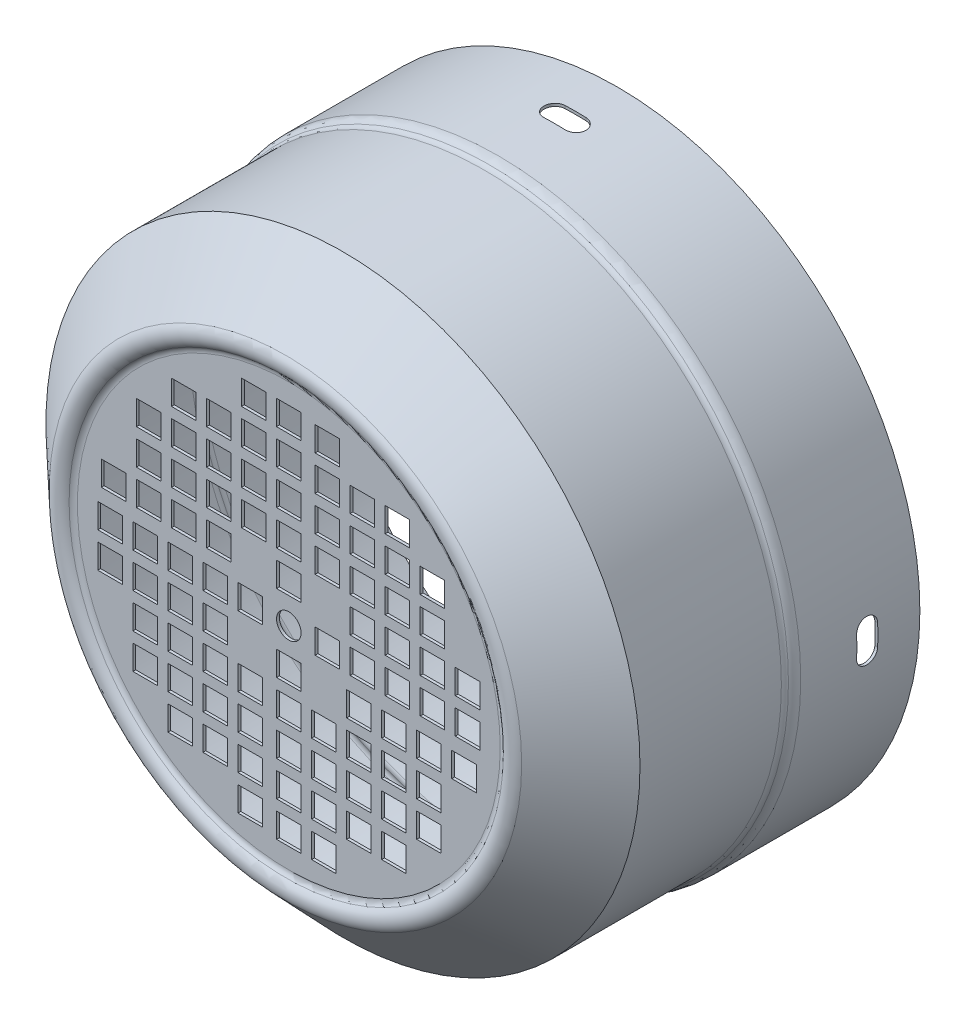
SolidWorks part; units mm, degrees
ref_plane "前视基准面" through (0, 0, 0) normal (0, 0, 1) x (1, 0, 0)
ref_plane "上视基准面" through (0, 0, 0) normal (0, 1, 0) x (1, 0, 0)
ref_plane "右视基准面" through (0, 0, 0) normal (1, 0, 0) x (0, 0, -1)
sketch "草图1" plane through (0, 0, 0) normal (0, 1, 0) x (1, 0, 0)
  line L0 (0, 0) -> (0, 95.7915) construction
  line L1 (83.9685, 57) -> (83.9685, 56.8734)
  line L2 (85.4963, 95) -> (85.4963, 61)
  line L4 (83.9685, 56.8734) -> (83.9685, 17)
  line L5 (0, 2) -> (60.3336, 2)
  line L6 (83.9685, 17) -> (66.8675, 0.8208)
  arc A0 (85.4963, 61) -> (84.7324, 59) centre (82.4963, 61) cw
  arc A1 (83.9685, 57) -> (84.7324, 59) centre (86.9685, 57) cw
  arc A2 (66.8675, 0.8208) -> (62.5697, 1) centre (64.8057, 3) cw
  arc A3 (62.5697, 1) -> (60.3336, 2) centre (60.3336, -1) ccw
  point P15 (66, 0)
  dimension "D2" = 3
  dimension "D3" = 3
  dimension "D9" = 3
  dimension "D11" = 3
  dimension "D1" = 85.5
  dimension "D4" = 36
  dimension "D5" = 2
  dimension "D6" = 78
  dimension "D7" = 95
  dimension "D8" = 66
revolve "旋转-薄壁2" add sketch "草图1" angle 360 about L0
sketch "草图2" plane through (0, 0, -1.2) normal (0, 0, 1) x (1, 0, 0)
  line L0 (7.5, 3.5) -> (7.5, -3.5)
  line L2 (7.5, 3.5) -> (14.5, 3.5)
  line L3 (14.5, 3.5) -> (14.5, -3.5)
  line L4 (14.5, -3.5) -> (7.5, -3.5)
  line L18 (17.5, 3.5) -> (17.5, -3.5)
  line L19 (24.5, -3.5) -> (17.5, -3.5)
  line L20 (24.5, 3.5) -> (24.5, -3.5)
  line L21 (17.5, 3.5) -> (24.5, 3.5)
  line L22 (27.5, 3.5) -> (27.5, -3.5)
  line L23 (34.5, -3.5) -> (27.5, -3.5)
  line L24 (34.5, 3.5) -> (34.5, -3.5)
  line L25 (27.5, 3.5) -> (34.5, 3.5)
  line L26 (37.5, 3.5) -> (37.5, -3.5)
  line L27 (44.5, -3.5) -> (37.5, -3.5)
  line L28 (44.5, 3.5) -> (44.5, -3.5)
  line L29 (37.5, 3.5) -> (44.5, 3.5)
  line L30 (47.5, 3.5) -> (47.5, -3.5)
  line L31 (54.5, -3.5) -> (47.5, -3.5)
  line L32 (54.5, 3.5) -> (54.5, -3.5)
  line L33 (47.5, 3.5) -> (54.5, 3.5)
  line L38 (7.5, 23.5) -> (7.5, 16.5)
  line L39 (14.5, 16.5) -> (7.5, 16.5)
  line L40 (14.5, 23.5) -> (14.5, 16.5)
  line L41 (7.5, 23.5) -> (14.5, 23.5)
  line L42 (7.5, 33.5) -> (7.5, 26.5)
  line L43 (14.5, 26.5) -> (7.5, 26.5)
  line L44 (14.5, 33.5) -> (14.5, 26.5)
  line L45 (7.5, 33.5) -> (14.5, 33.5)
  line L46 (7.5, 43.5) -> (7.5, 36.5)
  line L47 (14.5, 36.5) -> (7.5, 36.5)
  line L48 (14.5, 43.5) -> (14.5, 36.5)
  line L49 (7.5, 43.5) -> (14.5, 43.5)
  line L50 (7.5, 53.5) -> (7.5, 46.5)
  line L51 (14.5, 46.5) -> (7.5, 46.5)
  line L52 (14.5, 53.5) -> (14.5, 46.5)
  line L53 (7.5, 53.5) -> (14.5, 53.5)
  line L54 (17.5, 13.5) -> (17.5, 6.5)
  line L55 (24.5, 6.5) -> (17.5, 6.5)
  line L56 (24.5, 13.5) -> (24.5, 6.5)
  line L57 (17.5, 13.5) -> (24.5, 13.5)
  line L58 (27.5, 13.5) -> (27.5, 6.5)
  line L59 (34.5, 6.5) -> (27.5, 6.5)
  line L60 (34.5, 13.5) -> (34.5, 6.5)
  line L61 (27.5, 13.5) -> (34.5, 13.5)
  line L62 (37.5, 13.5) -> (37.5, 6.5)
  line L63 (44.5, 6.5) -> (37.5, 6.5)
  line L64 (44.5, 13.5) -> (44.5, 6.5)
  line L65 (37.5, 13.5) -> (44.5, 13.5)
  line L66 (47.5, 13.5) -> (47.5, 6.5)
  line L67 (54.5, 6.5) -> (47.5, 6.5)
  line L68 (54.5, 13.5) -> (54.5, 6.5)
  line L69 (47.5, 13.5) -> (54.5, 13.5)
  line L70 (17.5, 23.5) -> (17.5, 16.5)
  line L71 (24.5, 16.5) -> (17.5, 16.5)
  line L72 (24.5, 23.5) -> (24.5, 16.5)
  line L73 (17.5, 23.5) -> (24.5, 23.5)
  line L74 (27.5, 23.5) -> (27.5, 16.5)
  line L75 (34.5, 16.5) -> (27.5, 16.5)
  line L76 (34.5, 23.5) -> (34.5, 16.5)
  line L77 (27.5, 23.5) -> (34.5, 23.5)
  line L78 (37.5, 23.5) -> (37.5, 16.5)
  line L79 (44.5, 16.5) -> (37.5, 16.5)
  line L80 (44.5, 23.5) -> (44.5, 16.5)
  line L81 (37.5, 23.5) -> (44.5, 23.5)
  line L82 (17.5, 33.5) -> (17.5, 26.5)
  line L83 (24.5, 26.5) -> (17.5, 26.5)
  line L84 (24.5, 33.5) -> (24.5, 26.5)
  line L85 (17.5, 33.5) -> (24.5, 33.5)
  line L86 (27.5, 33.5) -> (27.5, 26.5)
  line L87 (34.5, 26.5) -> (27.5, 26.5)
  line L88 (34.5, 33.5) -> (34.5, 26.5)
  line L89 (27.5, 33.5) -> (34.5, 33.5)
  line L90 (37.5, 33.5) -> (37.5, 26.5)
  line L91 (44.5, 26.5) -> (37.5, 26.5)
  line L92 (44.5, 33.5) -> (44.5, 26.5)
  line L93 (37.5, 33.5) -> (44.5, 33.5)
  line L94 (17.5, 43.5) -> (17.5, 36.5)
  line L95 (24.5, 36.5) -> (17.5, 36.5)
  line L96 (24.5, 43.5) -> (24.5, 36.5)
  line L97 (17.5, 43.5) -> (24.5, 43.5)
  line L98 (27.5, 43.5) -> (27.5, 36.5)
  line L99 (34.5, 36.5) -> (27.5, 36.5)
  line L100 (34.5, 43.5) -> (34.5, 36.5)
  line L101 (27.5, 43.5) -> (34.5, 43.5)
  line L102 (3.5, -7.5) -> (-3.5, -7.5)
  line L103 (-3.5, -14.5) -> (-3.5, -7.5)
  line L104 (3.5, -14.5) -> (-3.5, -14.5)
  line L105 (3.5, -7.5) -> (3.5, -14.5)
  line L106 (3.5, -17.5) -> (-3.5, -17.5)
  line L107 (-3.5, -24.5) -> (-3.5, -17.5)
  line L108 (3.5, -24.5) -> (-3.5, -24.5)
  line L109 (3.5, -17.5) -> (3.5, -24.5)
  line L110 (3.5, -27.5) -> (-3.5, -27.5)
  line L111 (-3.5, -34.5) -> (-3.5, -27.5)
  line L112 (3.5, -34.5) -> (-3.5, -34.5)
  line L113 (3.5, -27.5) -> (3.5, -34.5)
  line L114 (3.5, -37.5) -> (-3.5, -37.5)
  line L115 (-3.5, -44.5) -> (-3.5, -37.5)
  line L116 (3.5, -44.5) -> (-3.5, -44.5)
  line L117 (3.5, -37.5) -> (3.5, -44.5)
  line L118 (3.5, -47.5) -> (-3.5, -47.5)
  line L119 (-3.5, -54.5) -> (-3.5, -47.5)
  line L120 (3.5, -54.5) -> (-3.5, -54.5)
  line L121 (3.5, -47.5) -> (3.5, -54.5)
  line L122 (13.5, -47.5) -> (6.5, -47.5)
  line L123 (6.5, -54.5) -> (6.5, -47.5)
  line L124 (13.5, -54.5) -> (6.5, -54.5)
  line L125 (13.5, -47.5) -> (13.5, -54.5)
  line L126 (13.5, -37.5) -> (6.5, -37.5)
  line L127 (6.5, -44.5) -> (6.5, -37.5)
  line L128 (13.5, -44.5) -> (6.5, -44.5)
  line L129 (13.5, -37.5) -> (13.5, -44.5)
  line L130 (13.5, -27.5) -> (6.5, -27.5)
  line L131 (6.5, -34.5) -> (6.5, -27.5)
  line L132 (13.5, -34.5) -> (6.5, -34.5)
  line L133 (13.5, -27.5) -> (13.5, -34.5)
  line L134 (13.5, -17.5) -> (6.5, -17.5)
  line L135 (6.5, -24.5) -> (6.5, -17.5)
  line L136 (13.5, -24.5) -> (6.5, -24.5)
  line L137 (13.5, -17.5) -> (13.5, -24.5)
  line L142 (23.5, -7.5) -> (16.5, -7.5)
  line L143 (16.5, -14.5) -> (16.5, -7.5)
  line L144 (23.5, -14.5) -> (16.5, -14.5)
  line L145 (23.5, -7.5) -> (23.5, -14.5)
  line L146 (23.5, -17.5) -> (16.5, -17.5)
  line L147 (16.5, -24.5) -> (16.5, -17.5)
  line L148 (23.5, -24.5) -> (16.5, -24.5)
  line L149 (23.5, -17.5) -> (23.5, -24.5)
  line L150 (23.5, -27.5) -> (16.5, -27.5)
  line L151 (16.5, -34.5) -> (16.5, -27.5)
  line L152 (23.5, -34.5) -> (16.5, -34.5)
  line L153 (23.5, -27.5) -> (23.5, -34.5)
  line L154 (23.5, -37.5) -> (16.5, -37.5)
  line L155 (16.5, -44.5) -> (16.5, -37.5)
  line L156 (23.5, -44.5) -> (16.5, -44.5)
  line L157 (23.5, -37.5) -> (23.5, -44.5)
  line L158 (33.5, -37.5) -> (26.5, -37.5)
  line L159 (26.5, -44.5) -> (26.5, -37.5)
  line L160 (33.5, -44.5) -> (26.5, -44.5)
  line L161 (33.5, -37.5) -> (33.5, -44.5)
  line L162 (33.5, -27.5) -> (26.5, -27.5)
  line L163 (26.5, -34.5) -> (26.5, -27.5)
  line L164 (33.5, -34.5) -> (26.5, -34.5)
  line L165 (33.5, -27.5) -> (33.5, -34.5)
  line L166 (33.5, -17.5) -> (26.5, -17.5)
  line L167 (26.5, -24.5) -> (26.5, -17.5)
  line L168 (33.5, -24.5) -> (26.5, -24.5)
  line L169 (33.5, -17.5) -> (33.5, -24.5)
  line L170 (33.5, -7.5) -> (26.5, -7.5)
  line L171 (26.5, -14.5) -> (26.5, -7.5)
  line L172 (33.5, -14.5) -> (26.5, -14.5)
  line L173 (33.5, -7.5) -> (33.5, -14.5)
  line L174 (43.5, -7.5) -> (36.5, -7.5)
  line L175 (36.5, -14.5) -> (36.5, -7.5)
  line L176 (43.5, -14.5) -> (36.5, -14.5)
  line L177 (43.5, -7.5) -> (43.5, -14.5)
  line L178 (43.5, -17.5) -> (36.5, -17.5)
  line L179 (36.5, -24.5) -> (36.5, -17.5)
  line L180 (43.5, -24.5) -> (36.5, -24.5)
  line L181 (43.5, -17.5) -> (43.5, -24.5)
  line L182 (43.5, -27.5) -> (36.5, -27.5)
  line L183 (36.5, -34.5) -> (36.5, -27.5)
  line L184 (43.5, -34.5) -> (36.5, -34.5)
  line L185 (43.5, -27.5) -> (43.5, -34.5)
  line L186 (53.5, -7.5) -> (46.5, -7.5)
  line L187 (46.5, -14.5) -> (46.5, -7.5)
  line L188 (53.5, -14.5) -> (46.5, -14.5)
  line L189 (53.5, -7.5) -> (53.5, -14.5)
  line L190 (-7.5, -3.5) -> (-7.5, 3.5)
  line L191 (-14.5, 3.5) -> (-7.5, 3.5)
  line L192 (-14.5, -3.5) -> (-14.5, 3.5)
  line L193 (-7.5, -3.5) -> (-14.5, -3.5)
  line L194 (-17.5, -3.5) -> (-17.5, 3.5)
  line L195 (-24.5, 3.5) -> (-17.5, 3.5)
  line L196 (-24.5, -3.5) -> (-24.5, 3.5)
  line L197 (-17.5, -3.5) -> (-24.5, -3.5)
  line L198 (-27.5, -3.5) -> (-27.5, 3.5)
  line L199 (-34.5, 3.5) -> (-27.5, 3.5)
  line L200 (-34.5, -3.5) -> (-34.5, 3.5)
  line L201 (-27.5, -3.5) -> (-34.5, -3.5)
  line L202 (-37.5, -3.5) -> (-37.5, 3.5)
  line L203 (-44.5, 3.5) -> (-37.5, 3.5)
  line L204 (-44.5, -3.5) -> (-44.5, 3.5)
  line L205 (-37.5, -3.5) -> (-44.5, -3.5)
  line L206 (-47.5, -3.5) -> (-47.5, 3.5)
  line L207 (-54.5, 3.5) -> (-47.5, 3.5)
  line L208 (-54.5, -3.5) -> (-54.5, 3.5)
  line L209 (-47.5, -3.5) -> (-54.5, -3.5)
  line L210 (-47.5, -13.5) -> (-47.5, -6.5)
  line L211 (-54.5, -6.5) -> (-47.5, -6.5)
  line L212 (-54.5, -13.5) -> (-54.5, -6.5)
  line L213 (-47.5, -13.5) -> (-54.5, -13.5)
  line L214 (-37.5, -13.5) -> (-37.5, -6.5)
  line L215 (-44.5, -6.5) -> (-37.5, -6.5)
  line L216 (-44.5, -13.5) -> (-44.5, -6.5)
  line L217 (-37.5, -13.5) -> (-44.5, -13.5)
  line L218 (-27.5, -13.5) -> (-27.5, -6.5)
  line L219 (-34.5, -6.5) -> (-27.5, -6.5)
  line L220 (-34.5, -13.5) -> (-34.5, -6.5)
  line L221 (-27.5, -13.5) -> (-34.5, -13.5)
  line L222 (-17.5, -13.5) -> (-17.5, -6.5)
  line L223 (-24.5, -6.5) -> (-17.5, -6.5)
  line L224 (-24.5, -13.5) -> (-24.5, -6.5)
  line L225 (-17.5, -13.5) -> (-24.5, -13.5)
  line L230 (-7.5, -23.5) -> (-7.5, -16.5)
  line L231 (-14.5, -16.5) -> (-7.5, -16.5)
  line L232 (-14.5, -23.5) -> (-14.5, -16.5)
  line L233 (-7.5, -23.5) -> (-14.5, -23.5)
  line L234 (-17.5, -23.5) -> (-17.5, -16.5)
  line L235 (-24.5, -16.5) -> (-17.5, -16.5)
  line L236 (-24.5, -23.5) -> (-24.5, -16.5)
  line L237 (-17.5, -23.5) -> (-24.5, -23.5)
  line L238 (-27.5, -23.5) -> (-27.5, -16.5)
  line L239 (-34.5, -16.5) -> (-27.5, -16.5)
  line L240 (-34.5, -23.5) -> (-34.5, -16.5)
  line L241 (-27.5, -23.5) -> (-34.5, -23.5)
  line L242 (-37.5, -23.5) -> (-37.5, -16.5)
  line L243 (-44.5, -16.5) -> (-37.5, -16.5)
  line L244 (-44.5, -23.5) -> (-44.5, -16.5)
  line L245 (-37.5, -23.5) -> (-44.5, -23.5)
  line L246 (-37.5, -33.5) -> (-37.5, -26.5)
  line L247 (-44.5, -26.5) -> (-37.5, -26.5)
  line L248 (-44.5, -33.5) -> (-44.5, -26.5)
  line L249 (-37.5, -33.5) -> (-44.5, -33.5)
  line L250 (-27.5, -33.5) -> (-27.5, -26.5)
  line L251 (-34.5, -26.5) -> (-27.5, -26.5)
  line L252 (-34.5, -33.5) -> (-34.5, -26.5)
  line L253 (-27.5, -33.5) -> (-34.5, -33.5)
  line L254 (-17.5, -33.5) -> (-17.5, -26.5)
  line L255 (-24.5, -26.5) -> (-17.5, -26.5)
  line L256 (-24.5, -33.5) -> (-24.5, -26.5)
  line L257 (-17.5, -33.5) -> (-24.5, -33.5)
  line L258 (-7.5, -33.5) -> (-7.5, -26.5)
  line L259 (-14.5, -26.5) -> (-7.5, -26.5)
  line L260 (-14.5, -33.5) -> (-14.5, -26.5)
  line L261 (-7.5, -33.5) -> (-14.5, -33.5)
  line L262 (-7.5, -43.5) -> (-7.5, -36.5)
  line L263 (-14.5, -36.5) -> (-7.5, -36.5)
  line L264 (-14.5, -43.5) -> (-14.5, -36.5)
  line L265 (-7.5, -43.5) -> (-14.5, -43.5)
  line L266 (-17.5, -43.5) -> (-17.5, -36.5)
  line L267 (-24.5, -36.5) -> (-17.5, -36.5)
  line L268 (-24.5, -43.5) -> (-24.5, -36.5)
  line L269 (-17.5, -43.5) -> (-24.5, -43.5)
  line L270 (-27.5, -43.5) -> (-27.5, -36.5)
  line L271 (-34.5, -36.5) -> (-27.5, -36.5)
  line L272 (-34.5, -43.5) -> (-34.5, -36.5)
  line L273 (-27.5, -43.5) -> (-34.5, -43.5)
  line L274 (-7.5, -53.5) -> (-7.5, -46.5)
  line L275 (-14.5, -46.5) -> (-7.5, -46.5)
  line L276 (-14.5, -53.5) -> (-14.5, -46.5)
  line L277 (-7.5, -53.5) -> (-14.5, -53.5)
  line L278 (-3.5, 7.5) -> (3.5, 7.5)
  line L279 (3.5, 14.5) -> (3.5, 7.5)
  line L280 (-3.5, 14.5) -> (3.5, 14.5)
  line L281 (-3.5, 7.5) -> (-3.5, 14.5)
  line L282 (-3.5, 17.5) -> (3.5, 17.5)
  line L283 (3.5, 24.5) -> (3.5, 17.5)
  line L284 (-3.5, 24.5) -> (3.5, 24.5)
  line L285 (-3.5, 17.5) -> (-3.5, 24.5)
  line L286 (-3.5, 27.5) -> (3.5, 27.5)
  line L287 (3.5, 34.5) -> (3.5, 27.5)
  line L288 (-3.5, 34.5) -> (3.5, 34.5)
  line L289 (-3.5, 27.5) -> (-3.5, 34.5)
  line L290 (-3.5, 37.5) -> (3.5, 37.5)
  line L291 (3.5, 44.5) -> (3.5, 37.5)
  line L292 (-3.5, 44.5) -> (3.5, 44.5)
  line L293 (-3.5, 37.5) -> (-3.5, 44.5)
  line L294 (-3.5, 47.5) -> (3.5, 47.5)
  line L295 (3.5, 54.5) -> (3.5, 47.5)
  line L296 (-3.5, 54.5) -> (3.5, 54.5)
  line L297 (-3.5, 47.5) -> (-3.5, 54.5)
  line L298 (-13.5, 47.5) -> (-6.5, 47.5)
  line L299 (-6.5, 54.5) -> (-6.5, 47.5)
  line L300 (-13.5, 54.5) -> (-6.5, 54.5)
  line L301 (-13.5, 47.5) -> (-13.5, 54.5)
  line L302 (-13.5, 37.5) -> (-6.5, 37.5)
  line L303 (-6.5, 44.5) -> (-6.5, 37.5)
  line L304 (-13.5, 44.5) -> (-6.5, 44.5)
  line L305 (-13.5, 37.5) -> (-13.5, 44.5)
  line L306 (-13.5, 27.5) -> (-6.5, 27.5)
  line L307 (-6.5, 34.5) -> (-6.5, 27.5)
  line L308 (-13.5, 34.5) -> (-6.5, 34.5)
  line L309 (-13.5, 27.5) -> (-13.5, 34.5)
  line L310 (-13.5, 17.5) -> (-6.5, 17.5)
  line L311 (-6.5, 24.5) -> (-6.5, 17.5)
  line L312 (-13.5, 24.5) -> (-6.5, 24.5)
  line L313 (-13.5, 17.5) -> (-13.5, 24.5)
  line L318 (-23.5, 7.5) -> (-16.5, 7.5)
  line L319 (-16.5, 14.5) -> (-16.5, 7.5)
  line L320 (-23.5, 14.5) -> (-16.5, 14.5)
  line L321 (-23.5, 7.5) -> (-23.5, 14.5)
  line L322 (-23.5, 17.5) -> (-16.5, 17.5)
  line L323 (-16.5, 24.5) -> (-16.5, 17.5)
  line L324 (-23.5, 24.5) -> (-16.5, 24.5)
  line L325 (-23.5, 17.5) -> (-23.5, 24.5)
  line L326 (-23.5, 27.5) -> (-16.5, 27.5)
  line L327 (-16.5, 34.5) -> (-16.5, 27.5)
  line L328 (-23.5, 34.5) -> (-16.5, 34.5)
  line L329 (-23.5, 27.5) -> (-23.5, 34.5)
  line L330 (-23.5, 37.5) -> (-16.5, 37.5)
  line L331 (-16.5, 44.5) -> (-16.5, 37.5)
  line L332 (-23.5, 44.5) -> (-16.5, 44.5)
  line L333 (-23.5, 37.5) -> (-23.5, 44.5)
  line L334 (-33.5, 37.5) -> (-26.5, 37.5)
  line L335 (-26.5, 44.5) -> (-26.5, 37.5)
  line L336 (-33.5, 44.5) -> (-26.5, 44.5)
  line L337 (-33.5, 37.5) -> (-33.5, 44.5)
  line L338 (-33.5, 27.5) -> (-26.5, 27.5)
  line L339 (-26.5, 34.5) -> (-26.5, 27.5)
  line L340 (-33.5, 34.5) -> (-26.5, 34.5)
  line L341 (-33.5, 27.5) -> (-33.5, 34.5)
  line L342 (-33.5, 17.5) -> (-26.5, 17.5)
  line L343 (-26.5, 24.5) -> (-26.5, 17.5)
  line L344 (-33.5, 24.5) -> (-26.5, 24.5)
  line L345 (-33.5, 17.5) -> (-33.5, 24.5)
  line L346 (-33.5, 7.5) -> (-26.5, 7.5)
  line L347 (-26.5, 14.5) -> (-26.5, 7.5)
  line L348 (-33.5, 14.5) -> (-26.5, 14.5)
  line L349 (-33.5, 7.5) -> (-33.5, 14.5)
  line L350 (-43.5, 7.5) -> (-36.5, 7.5)
  line L351 (-36.5, 14.5) -> (-36.5, 7.5)
  line L352 (-43.5, 14.5) -> (-36.5, 14.5)
  line L353 (-43.5, 7.5) -> (-43.5, 14.5)
  line L354 (-43.5, 17.5) -> (-36.5, 17.5)
  line L355 (-36.5, 24.5) -> (-36.5, 17.5)
  line L356 (-43.5, 24.5) -> (-36.5, 24.5)
  line L357 (-43.5, 17.5) -> (-43.5, 24.5)
  line L358 (-43.5, 27.5) -> (-36.5, 27.5)
  line L359 (-36.5, 34.5) -> (-36.5, 27.5)
  line L360 (-43.5, 34.5) -> (-36.5, 34.5)
  line L361 (-43.5, 27.5) -> (-43.5, 34.5)
  line L362 (-53.5, 7.5) -> (-46.5, 7.5)
  line L363 (-46.5, 14.5) -> (-46.5, 7.5)
  line L364 (-53.5, 14.5) -> (-46.5, 14.5)
  line L365 (-53.5, 7.5) -> (-53.5, 14.5)
  line L374 (7.5, 13.5) -> (14.5, 13.5)
  line L375 (14.5, 13.5) -> (14.5, 6.5)
  line L376 (14.5, 6.5) -> (7.5, 6.5)
  line L377 (7.5, 13.5) -> (7.5, 6.5)
  circle A0 centre (0, 0) radius 3.5
  point P22 (0, 0)
  point P359 (0, 0)
  dimension "D10" = 7
  dimension "D4" = 7.5
  dimension "D6" = 4
  dimension "D2" = 5
  dimension "D3" = 6
  dimension "D8" = 4
  dimension "D9" = 4
  dimension "D11" = 3
extrude "切除-拉伸1" cut sketch "草图2" against normal blind 10
sketch "草图3" plane through (0, 0, 0) normal (0, 1, 0) x (1, 0, 0)
  line L0 (0, 95) -> (0, 80) construction
  line L1 (86.2963, 95) -> (-86.2963, 95) construction
  line L2 (-3, 80) -> (3, 80) construction
  line L3 (-3, 83) -> (3, 83)
  line L4 (-3, 77) -> (3, 77)
  arc A0 (-3, 83) -> (-3, 77) centre (-3, 80) ccw
  arc A1 (3, 77) -> (3, 83) centre (3, 80) ccw
  point P7 (0, 80)
  point P12 (-6, 80)
  point P13 (6, 80)
  dimension "D1" = 6
  dimension "D2" = 12
  dimension "D3" = 15
extrude "切除-拉伸2" cut sketch "草图3" against normal through all
pattern_circular "阵列(圆周)1" count 4 over 360 about axis through (0, 0, 0) along (0, 0, 1) of "切除-拉伸2"
